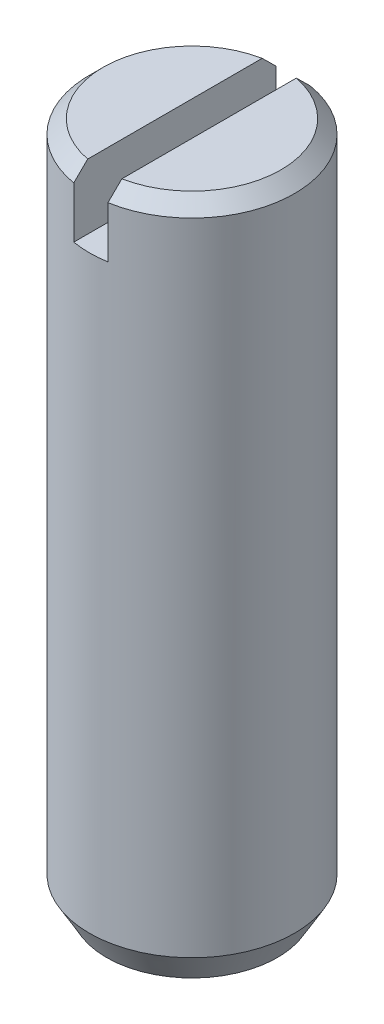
SolidWorks part; units mm, degrees
ref_plane "前视" through (0, 0, 0) normal (0, 0, 1) x (1, 0, 0)
ref_plane "上视" through (0, 0, 0) normal (0, 1, 0) x (1, 0, 0)
ref_plane "右视" through (0, 0, 0) normal (1, 0, 0) x (0, 0, -1)
sketch "草图10" plane through (0, 0, 0) normal (0, 1, 0) x (1, 0, 0)
  circle A0 centre (0, 0) radius 1.5
extrude "拉伸1" add sketch "草图10" along normal blind 10
sketch "草图12" plane through (0, 10, 0) normal (0, 1, 0) x (-1, 0, 0)
  line L1 (0.25, -1.5375) -> (-0.25, -1.5375)
  line L2 (0.25, -1.5375) -> (0.25, 1.637)
  line L3 (0.25, 1.637) -> (-0.25, 1.637)
  line L4 (-0.25, -1.5375) -> (-0.25, 1.637)
  dimension "D1" = 0.25
  dimension "D2" = 0.25
extrude "切除-拉伸5" cut sketch "草图12" against normal blind 0.9504
chamfer "倒角2" distance 0.2 angle 45 2 edges at (1.5, 10, 0) (-1.5, 10, 0)
chamfer "倒角3" distance 0.25 angle 60 1 edges at (0, 0, 1.5)
